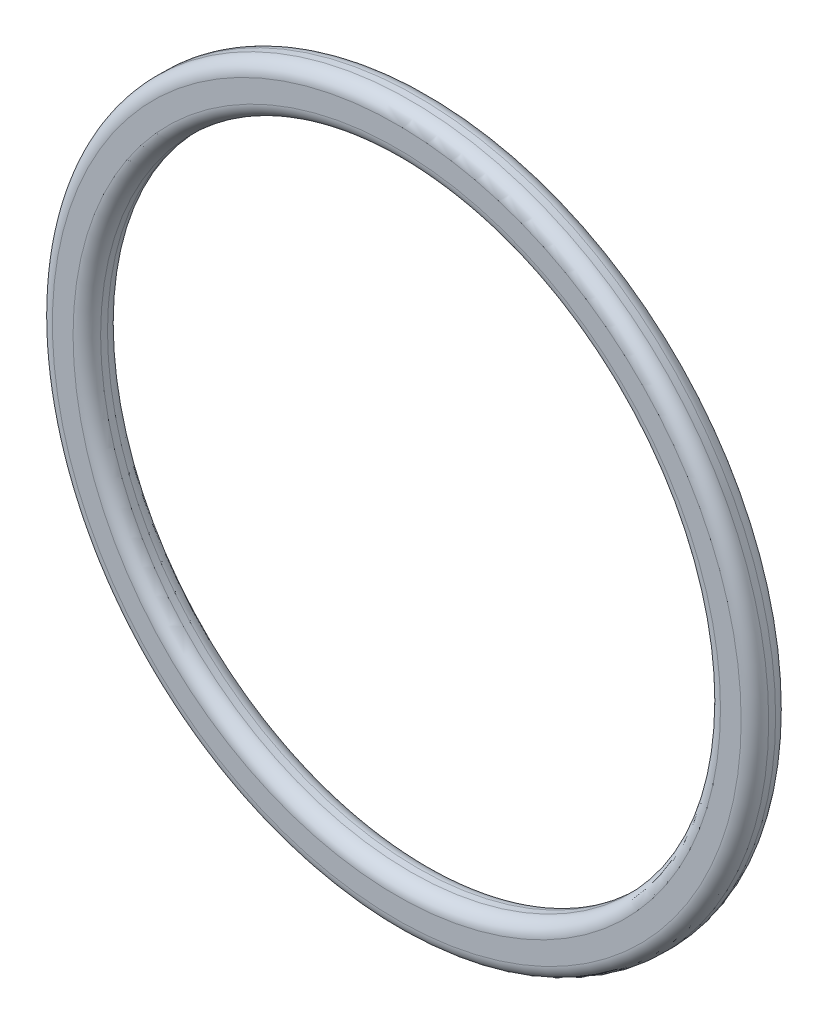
SolidWorks part; units mm, degrees
ref_plane "Plan de face" through (0, 0, 0) normal (0, 0, 1) x (1, 0, 0)
ref_plane "Plan de dessus" through (0, 0, 0) normal (0, 1, 0) x (1, 0, 0)
ref_plane "Plan de droite" through (0, 0, 0) normal (1, 0, 0) x (0, 0, -1)
sketch "Esquisse1" plane through (0, 0, 0) normal (1, 0, 0) x (0, 0, -1)
  line L0 (-20.8244, 0) -> (21.7431, 0) construction
  line L2 (1.4594, 26) -> (1.9594, 26)
  line L3 (0.4594, 25) -> (0.4594, 23.5)
  line L4 (1.4594, 22.5) -> (1.9594, 22.5)
  line L5 (2.9594, 25) -> (2.9594, 23.5)
  arc A0 (1.9594, 22.5) -> (2.9594, 23.5) centre (1.9594, 23.5) ccw
  arc A1 (1.9594, 26) -> (2.9594, 25) centre (1.9594, 25) cw
  arc A2 (1.4594, 26) -> (0.4594, 25) centre (1.4594, 25) ccw
  arc A3 (0.4594, 23.5) -> (1.4594, 22.5) centre (1.4594, 23.5) ccw
  dimension "D4" = 1
  dimension "D1" = 45
  dimension "D2" = 52
  dimension "D3" = 2.5
revolve "Révolution1" add sketch "Esquisse1" angle 360 about L0
